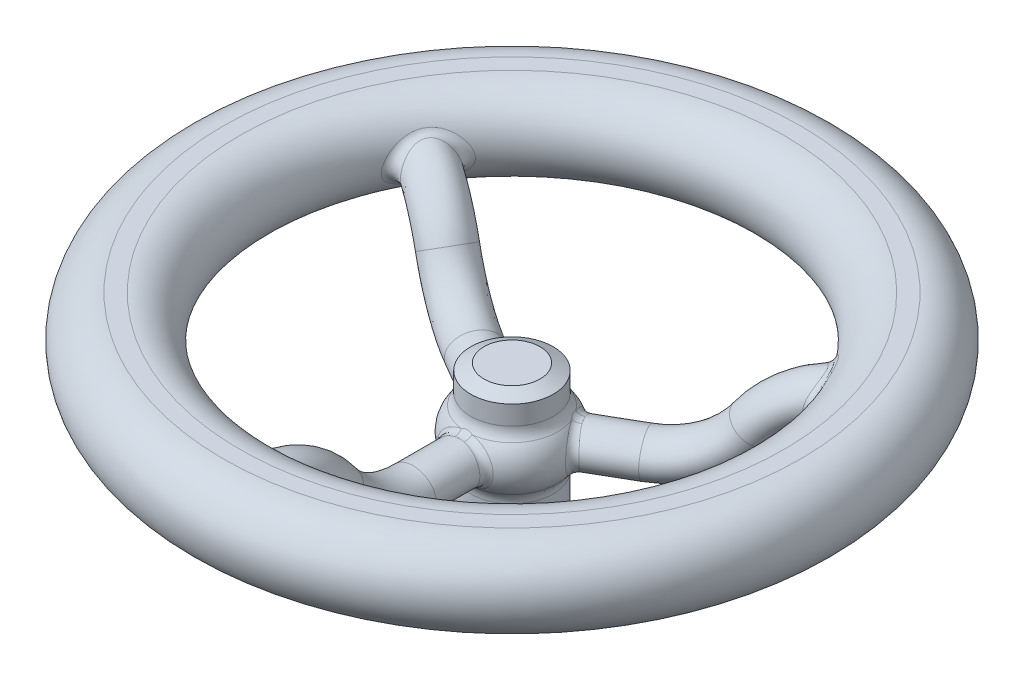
SolidWorks part; units mm, degrees
ref_plane "Front Plane" through (0, 0, 0) normal (0, 0, 1) x (1, 0, 0)
ref_plane "Top Plane" through (0, 0, 0) normal (0, 1, 0) x (1, 0, 0)
ref_plane "Right Plane" through (0, 0, 0) normal (1, 0, 0) x (0, 0, -1)
sketch "Sketch1" plane through (0, 0, 0) normal (1, 0, 0) x (0, 0, -1)
  line L0 (-12.5, 37.198) -> (-12.5, 45)
  line L1 (0, 0) -> (-12.5, 0)
  line L2 (0, 0) -> (0, 45) construction
  line L3 (0, 45) -> (-12.5, 45)
  line L4 (-12.5, 0) -> (-12.5, 16.802)
  line L5 (0, 0) -> (0, 45)
  arc A0 (-13.8333, 33.7987) -> (-13.8333, 20.2013) centre (-6.5, 27) ccw
  arc A1 (-13.8333, 20.2013) -> (-12.5, 16.802) centre (-17.5, 16.802) cw
  arc A2 (-13.8333, 33.7987) -> (-12.5, 37.198) centre (-17.5, 37.198) ccw
  point P10 (-12.5, 19)
  point P13 (-12.5, 35)
  dimension "D6" = 5
  dimension "D1" = 4
  dimension "D2" = 16
  dimension "D3" = 10
  dimension "D4" = 45
  dimension "D5" = 25
revolve "Hub" add sketch "Sketch1" angle 360 about L2
sketch "Sketch2" plane through (0, 0, 0) normal (1, 0, 0) x (0, 0, -1)
  line L0 (-87.5, 51) -> (-82.5, 51) construction
  line L1 (-87.5, 63.5) -> (-82.5, 63.5)
  line L2 (-87.5, 38.5) -> (-82.5, 38.5)
  line L3 (0, 0) -> (0, 50000) construction
  line L4 (12.5, 45) -> (-12.5, 45) construction
  arc A0 (-87.5, 63.5) -> (-87.5, 38.5) centre (-87.5, 51) ccw
  arc A1 (-82.5, 38.5) -> (-82.5, 63.5) centre (-82.5, 51) ccw
  point P2 (-85, 51)
  dimension "D1" = 25
  dimension "D2" = 30
  dimension "D4" = 6
revolve "Rim" add sketch "Sketch2" angle 360 about L3
sketch "Sketch4" plane through (0, 0, 0) normal (1, 0, 0) x (0, 0, -1)
  line L0 (0, 27) -> (-30, 27)
  line L1 (0, 0) -> (0, 45) construction
  line L2 (-76.9894, 51) -> (-85, 51)
  arc A0 (-30, 27) -> (-53.4947, 39) centre (-30, 56) cw
  arc A1 (-53.4947, 39) -> (-76.9894, 51) centre (-76.9894, 22) ccw
  dimension "D1" = 29
  dimension "D2" = 55
sketch "Sketch5" plane through (0, 0, 0) normal (0, 0, 1) x (1, 0, 0)
  ellipse E0 centre (0, 27) end of major axis (7, 27) minor radius 6
  dimension "D1" = 14
  dimension "D2" = 12
sweep "Spoke" add profiles "Sketch5" path "Sketch4"
pattern_circular "CirPattern1" count 3 over 360 of "Spoke"
fillet "Fillet1" radius 3 6 edges at (16.344, 25.7108, -1.5421) (-6.8365, 25.7108, 14.9253) (-9.5075, 25.7108, -13.3833) (-6.9999, 50.1029, 69.6815) (-57.0989, 48.7407, -40.8483) (63.9251, 48.7407, -29.0249)
chamfer "Chamfer1" distance 4 distance2 2 1 edges at (0, 45, -12.5)
